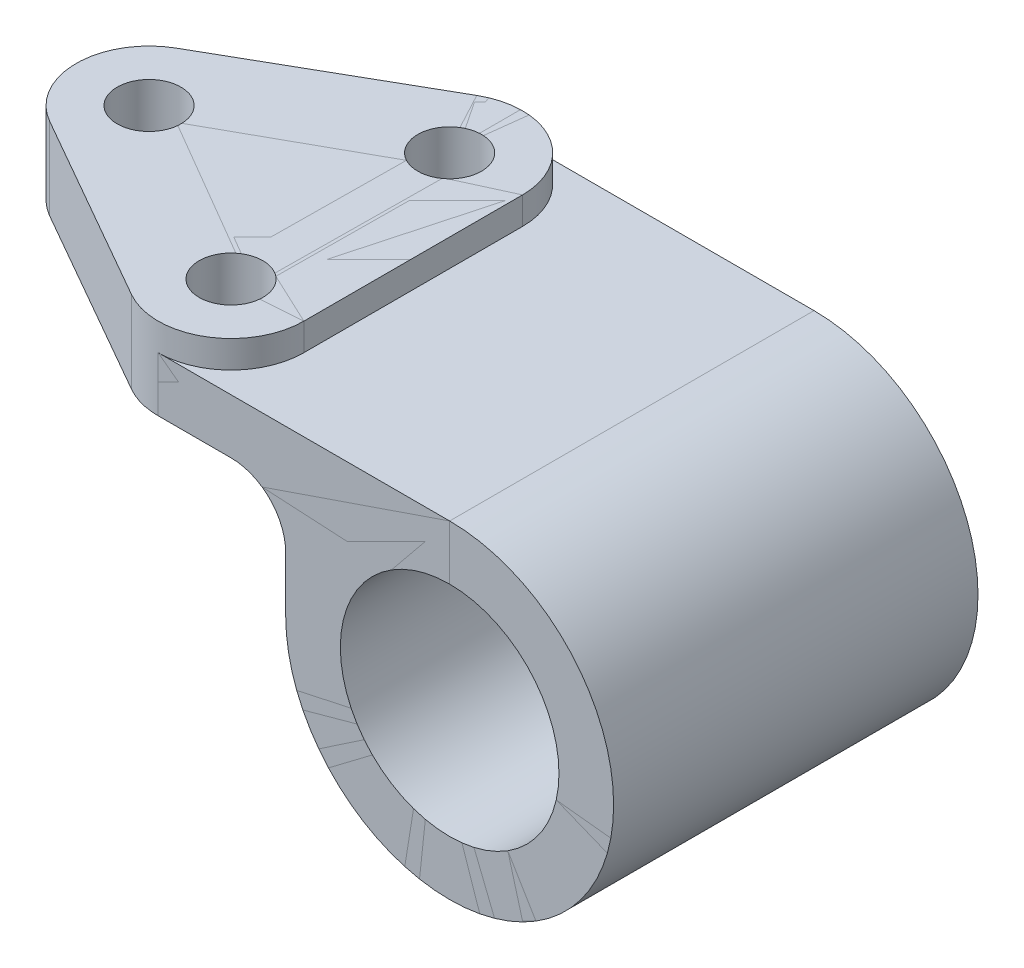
SolidWorks part; units mm, degrees
ref_plane "Front" through (0, 0, 0) normal (0, 0, 1) x (1, 0, 0)
ref_plane "Top" through (0, 0, 0) normal (0, 1, 0) x (1, 0, 0)
ref_plane "Right" through (0, 0, 0) normal (1, 0, 0) x (0, 0, -1)
sketch "Sketch1" plane through (0, 0, 0) normal (0, 0, 1) x (1, 0, 0)
  line L0 (-101.6, 28.575) -> (0, 28.575)
  line L1 (-28.575, 9.525) -> (-28.575, 0)
  line L2 (-101.6, 19.05) -> (-38.1, 19.05)
  line L3 (-101.6, 28.575) -> (-101.6, 19.05)
  arc A1 (-28.575, 0) -> (0, 28.575) centre (0, 0) ccw
  arc A2 (-38.1, 19.05) -> (-28.575, 9.525) centre (-38.1, 9.525) cw
  dimension "D1" = 57.15
  dimension "D4" = 9.525
  dimension "D3" = 9.525
  dimension "D5" = 101.6
extrude "Base-Extrude" add sketch "Sketch1" along normal mid plane 63.5
ref_plane "Plane1" through (0, 33.3375, 0) normal (0, 1, 0) x (-1, 0, 0)
sketch "Sketch2" plane through (0, 33.3375, 0) normal (0, 1, 0) x (-1, 0, 0)
  line L0 (84.1375, 0) -> (0, 0) construction
  line L1 (0, 50) -> (0, -50) construction
  line L2 (38.1, 31.75) -> (38.1, -31.75) construction
  line L3 (90.4385, -11.0267) -> (57.101, -30.0767)
  line L4 (38.1, -19.05) -> (38.1, 19.05)
  line L5 (57.101, 30.0767) -> (90.4385, 11.0267)
  circle A0 centre (50.8, -19.05) radius 5.5562 construction
  circle A1 centre (50.8, 19.05) radius 5.5562 construction
  circle A2 centre (84.1375, 0) radius 5.5563 construction
  arc A3 (57.101, -30.0767) -> (38.1, -19.05) centre (50.8, -19.05) cw
  arc A4 (57.101, 30.0767) -> (38.1, 19.05) centre (50.8, 19.05) ccw
  arc A5 (90.4385, -11.0267) -> (90.4385, 11.0267) centre (84.1375, 0) ccw
  dimension "D1" = 38.1
  dimension "D2" = 33.3375
  dimension "D3" = 11.1125
  dimension "D4" = 50.8
extrude "Boss-Extrude1" add sketch "Sketch2" against normal up to next
sketch "Sketch3" plane through (0, 28.575, 0) normal (0, 1, 0) x (-1, 0, 0)
  line L5 (90.4385, -11.0267) -> (57.101, -30.0767)
  line L6 (50.8, -31.75) -> (101.6, -31.75)
  line L7 (101.6, -31.75) -> (101.6, 31.75)
  line L8 (101.6, 31.75) -> (50.8, 31.75)
  line L9 (57.101, 30.0767) -> (90.4385, 11.0267)
  line L10 (90.4385, -11.0267) -> (57.101, -30.0767)
  line L11 (50.8, -31.75) -> (101.6, -31.75)
  line L12 (101.6, -31.75) -> (101.6, 31.75)
  line L13 (101.6, 31.75) -> (50.8, 31.75)
  line L14 (57.101, 30.0767) -> (90.4385, 11.0267)
  arc A3 (50.8, -31.75) -> (57.101, -30.0767) centre (50.8, -19.05) ccw
  arc A4 (57.101, 30.0767) -> (50.8, 31.75) centre (50.8, 19.05) ccw
  arc A5 (90.4385, -11.0267) -> (90.4385, 11.0267) centre (84.1375, 0) ccw
  arc A6 (50.8, -31.75) -> (57.101, -30.0767) centre (50.8, -19.05) ccw
  arc A7 (57.101, 30.0767) -> (50.8, 31.75) centre (50.8, 19.05) ccw
  arc A8 (90.4385, -11.0267) -> (90.4385, 11.0267) centre (84.1375, 0) ccw
  dimension "D1" = 0
extrude "Cut-Extrude1" cut sketch "Sketch3" against normal blind 38.1
sketch "Sketch4" plane through (0, 33.3375, 0) normal (0, 1, 0) x (-1, 0, 0)
  circle A0 centre (50.8, 19.05) radius 5.5562 construction
  circle A1 centre (50.8, -19.05) radius 5.5562 construction
  circle A2 centre (84.1375, 0) radius 5.5562 construction
  circle A3 centre (50.8, 19.05) radius 5.5562
  circle A4 centre (50.8, -19.05) radius 5.5562
  circle A5 centre (84.1375, 0) radius 5.5563
extrude "Cut-Extrude2" cut sketch "Sketch4" against normal through all
sketch "Sketch5" plane through (0, 0, 31.75) normal (0, 0, 1) x (1, 0, 0)
  circle A0 centre (0, 0) radius 19.05
  dimension "D1" = 38.1
extrude "Cut-Extrude3" cut sketch "Sketch5" against normal through all
other "DeleteFace1" [suppressed]
surface "Surface-Offset1" parameters "D1"=0
